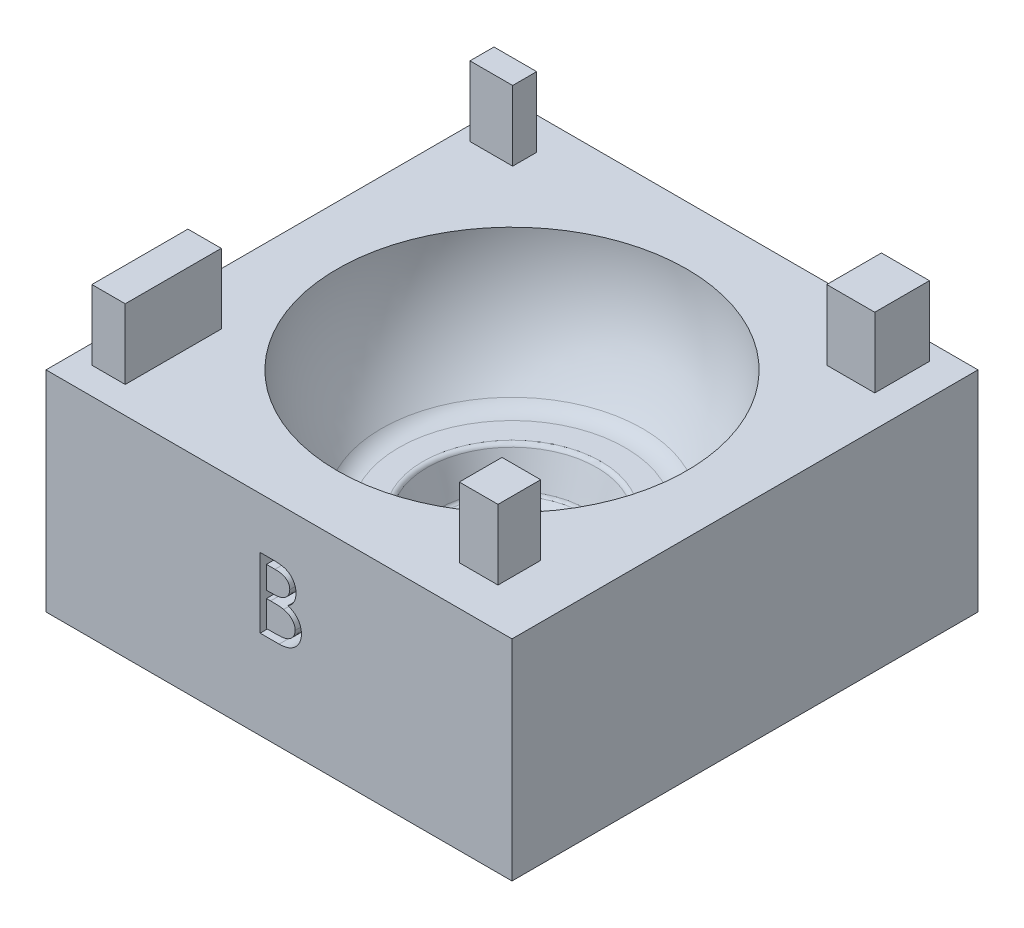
SolidWorks part; units mm, degrees
ref_plane "Front Plane" through (0, 0, 0) normal (0, 0, 1) x (1, 0, 0)
ref_plane "Top Plane" through (0, 0, 0) normal (0, 1, 0) x (1, 0, 0)
ref_plane "Right Plane" through (0, 0, 0) normal (1, 0, 0) x (0, 0, -1)
sketch "Sketch1" plane through (0, 0, 0) normal (0, 0, 1) x (1, 0, 0)
  line L0 (0, 26.5943) -> (0, -26.5943)
  line L1 (0, 0) -> (37.5, 0) construction
  line L2 (37.5, 0) -> (37.5, -44.45) construction
  line L3 (37.5, 0) -> (35.2986, -42.0057) construction
  line L4 (15.6328, -34.0862) -> (18.4385, -26.5943)
  line L5 (18.4385, -26.5943) -> (26.4385, -26.5943)
  line L6 (18.4385, 26.5943) -> (26.4385, 26.5943)
  line L7 (15.6328, 34.0862) -> (18.4385, 26.5943)
  line L8 (8.0848, -36.6181) -> (4.4365, -26.5943)
  line L9 (4.4365, -26.5943) -> (0, -26.5943)
  line L10 (8.0848, 36.6181) -> (4.4365, 26.5943)
  line L11 (4.4365, 26.5943) -> (0, 26.5943)
  arc A0 (8.0848, 36.6181) -> (15.6328, 34.0862) centre (0, 0) cw
  arc A1 (15.6328, -34.0862) -> (8.0848, -36.6181) centre (0, 0) cw
  arc A2 (15.6328, 34.0862) -> (8.0848, 36.6181) centre (0, 0) ccw
  arc A3 (26.4385, 26.5943) -> (26.4385, -26.5943) centre (0, 0) cw
  dimension "D1" = 37.5
  dimension "D2" = 3
  dimension "D3" = 110
  dimension "D4" = 8
  dimension "D5" = 14.002
  dimension "D6" = 4.4365
  dimension "D7" = 10.0238
revolve "Revolve1" add sketch "Sketch1" angle 360 about L0
fillet "Fillet1" radius 1 8 edges at (-18.4385, -26.5943, 0) (-15.6328, -34.0862, 0) (-8.0848, -36.6181, 0) (-4.4365, -26.5943, 0) (-4.4365, 26.5943, 0) (-8.0848, 36.6181, 0) (-15.6328, 34.0862, 0) (-18.4385, 26.5943, 0)
fillet "Fillet2" radius 5 2 edges at (-26.4385, 26.5943, 0) (-26.4385, -26.5943, 0)
sketch "Sketch3" plane through (0, 0, 0) normal (0, 1, 0) x (1, 0, 0)
  line L1 (-50, -50) -> (50, -50)
  line L2 (-50, -50) -> (-50, 50)
  line L3 (-50, 50) -> (50, 50)
  line L4 (50, -50) -> (50, 50)
  line L5 (-50, -50) -> (50, 50) construction
  line L6 (-50, 50) -> (50, -50) construction
  point P0 (0, 0)
  dimension "D1" = 100
extrude "Boss-Extrude1" add sketch "Sketch3" against normal blind 45 separate body
sketch "Sketch5" plane through (0, 0, 0) normal (0, 1, 0) x (1, 0, 0)
  line L1 (-46.9367, 43.073) -> (-37.7783, 43.073)
  line L2 (-46.9367, 43.073) -> (-46.9367, 37.9214)
  line L3 (-46.9367, 37.9214) -> (-37.7783, 37.9214)
  line L4 (-37.7783, 43.073) -> (-37.7783, 37.9214)
  line L5 (-46.9367, 43.073) -> (-37.7783, 37.9214) construction
  line L6 (-46.9367, 37.9214) -> (-37.7783, 43.073) construction
  line L7 (32.9129, 46.3643) -> (43.2161, 46.3643)
  line L8 (32.9129, 46.3643) -> (32.9129, 34.6301)
  line L9 (32.9129, 34.6301) -> (43.2161, 34.6301)
  line L10 (43.2161, 46.3643) -> (43.2161, 34.6301)
  line L11 (32.9129, 46.3643) -> (43.2161, 34.6301) construction
  line L12 (32.9129, 34.6301) -> (43.2161, 46.3643) construction
  line L13 (-45.935, -23.6115) -> (-38.78, -23.6115)
  line L14 (-45.935, -23.6115) -> (-45.935, -44.2178)
  line L15 (-45.935, -44.2178) -> (-38.78, -44.2178)
  line L16 (-38.78, -23.6115) -> (-38.78, -44.2178)
  line L17 (-45.935, -23.6115) -> (-38.78, -44.2178) construction
  line L18 (-45.935, -44.2178) -> (-38.78, -23.6115) construction
  line L19 (38.4938, -32.3405) -> (30.194, -32.3405)
  line L20 (38.4938, -32.3405) -> (38.4938, -41.4989)
  line L21 (38.4938, -41.4989) -> (30.194, -41.4989)
  line L22 (30.194, -32.3405) -> (30.194, -41.4989)
  line L23 (38.4938, -32.3405) -> (30.194, -41.4989) construction
  line L24 (38.4938, -41.4989) -> (30.194, -32.3405) construction
  point P0 (-42.3575, 40.4972)
  point P5 (38.0645, 40.4972)
  point P10 (-42.3575, -33.9146)
  point P15 (34.3439, -36.9197)
extrude "Boss-Extrude2" add sketch "Sketch5" along normal blind 15
sketch "Sketch6" plane through (0, 0, 50) normal (0, 0, 1) x (1, 0, 0)
  line L0 (-29.4275, -25.9559) -> (29.4275, -25.9559) construction
  text T0 "B" font "Century Gothic" height 15
  point P2 (0, -25.9559)
extrude "Cut-Extrude1" cut sketch "Sketch6" against normal blind 5
combine bodies "Combine1" operation type subtract main body 109 bodies to subtract 101
